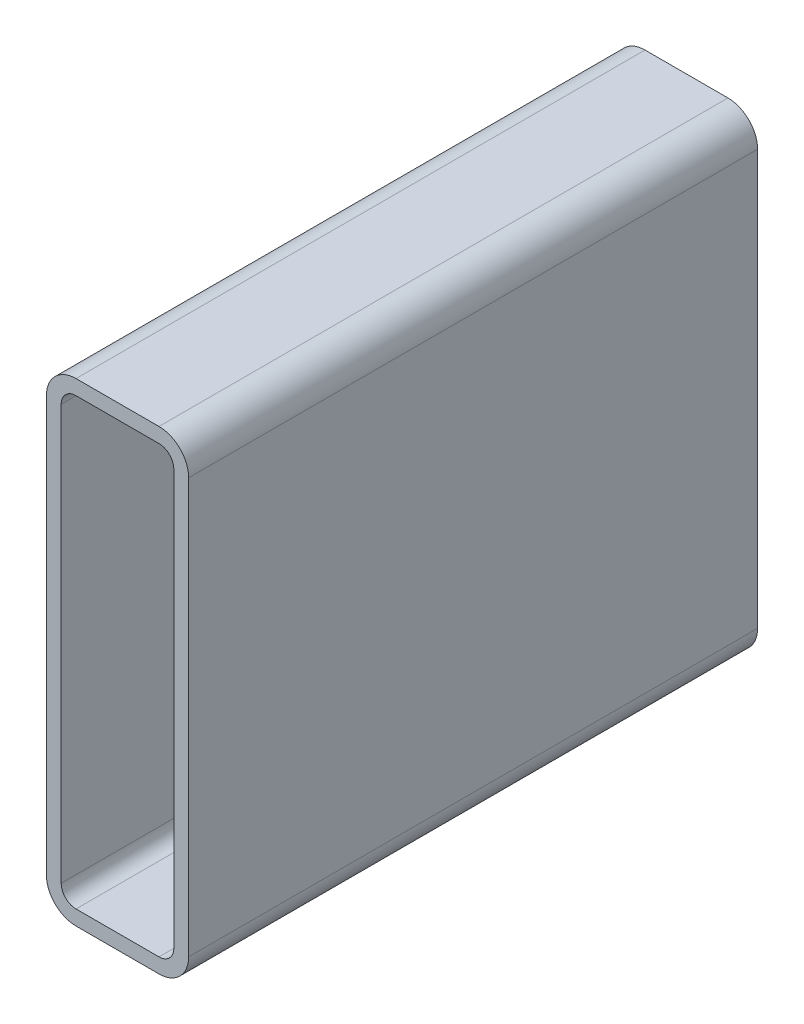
SolidWorks part; units mm, degrees
ref_plane "Front Plane" through (0, 0, 0) normal (0, 0, 1) x (1, 0, 0)
ref_plane "Top Plane" through (0, 0, 0) normal (0, 1, 0) x (1, 0, 0)
ref_plane "Right Plane" through (0, 0, 0) normal (1, 0, 0) x (0, 0, -1)
sketch "Sketch1" plane through (0, 0, 0) normal (0, 0, 1) x (1, 0, 0)
sketch_block_instance "HSS10x3x0.3125-1"
sketch_block "HSS10x3x0.3125"
extrude "Boss-Extrude1" add sketch "Sketch1" along normal blind 304.8
